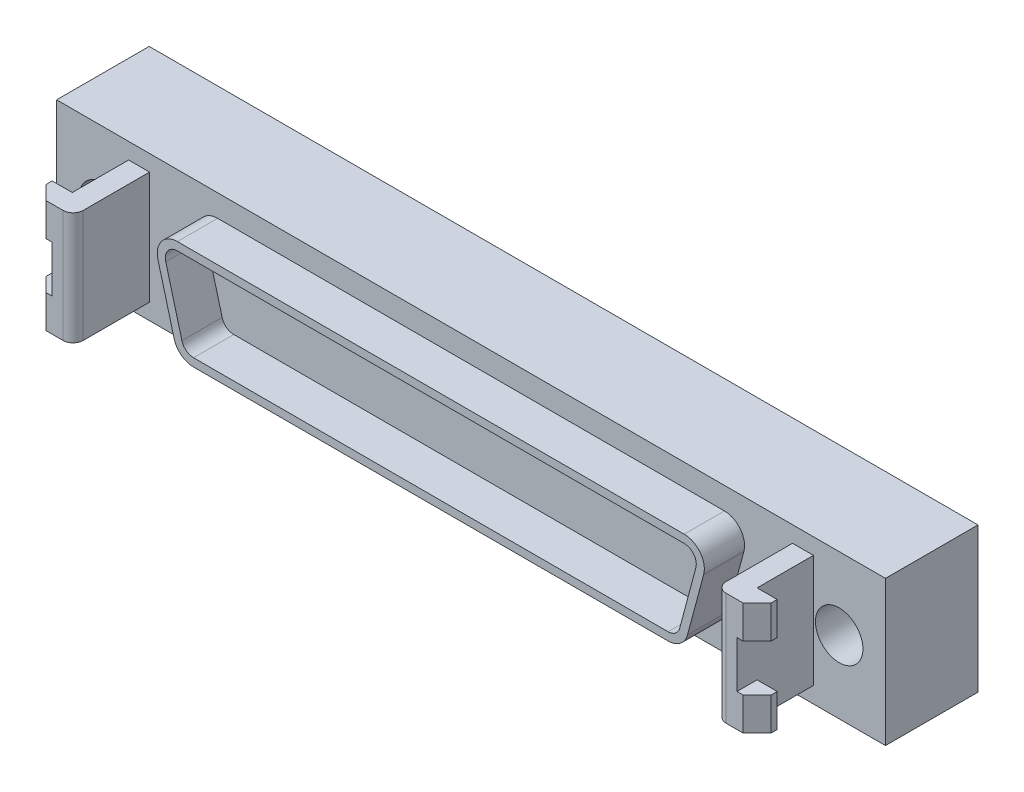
SolidWorks part; units mm, degrees
ref_plane "Front Plane" through (0, 0, 0) normal (0, 0, 1) x (1, 0, 0)
ref_plane "Top Plane" through (0, 0, 0) normal (0, 1, 0) x (1, 0, 0)
ref_plane "Right Plane" through (0, 0, 0) normal (1, 0, 0) x (0, 0, -1)
sketch "Base Outline" plane through (0, 0, 0) normal (0, 0, 1) x (1, 0, 0)
  line L0 (26.162, 0) -> (-26.162, 0) construction
  line L2 (-26.162, 4.572) -> (26.162, 4.572)
  line L3 (-26.162, 4.572) -> (-26.162, -4.572)
  line L4 (-26.162, -4.572) -> (26.162, -4.572)
  line L5 (26.162, 4.572) -> (26.162, -4.572)
  circle A0 centre (-23.241, 0) radius 1.4986
  circle A1 centre (23.241, 0) radius 1.4986
  point P5 (0, 0)
  point P6 (-26.162, 4.572)
  point P8 (26.162, -4.572)
  point P11 (-23.241, 0)
  point P12 (23.241, 0)
  dimension "D6" = 2.9972
  dimension "D7" = 2.9972
  dimension "D1" = 52.324
  dimension "D2" = 4.572
  dimension "D3" = 4.572
  dimension "D4" = 2.921
  dimension "D5" = 2.921
extrude "Connector Base" add sketch "Base Outline" along normal blind 5.842
sketch "Connector Outline" plane through (0, 0, 5.842) normal (0, 0, 1) x (1, 0, 0)
  line L0 (-15.9979, 3.175) -> (15.9979, 3.175)
  line L1 (-17.653, 3.175) -> (-17.653, -2.8641) construction
  line L2 (17.653, 3.175) -> (17.653, -2.8641) construction
  line L3 (-17.2246, 1.5763) -> (-16.2037, -2.2337)
  line L4 (17.2246, 1.5763) -> (16.2037, -2.2337)
  line L5 (14.977, -3.175) -> (-14.977, -3.175)
  arc A0 (-17.2246, 1.5763) -> (-15.9979, 3.175) centre (-15.9979, 1.905) cw
  arc A1 (-14.977, -3.175) -> (-16.2037, -2.2337) centre (-14.977, -1.905) cw
  arc A2 (16.2037, -2.2337) -> (14.977, -3.175) centre (14.977, -1.905) cw
  arc A3 (17.2246, 1.5763) -> (15.9979, 3.175) centre (15.9979, 1.905) ccw
  point P2 (0, 0)
  point P3 (0, 3.175)
  dimension "D6" = 1.27
  dimension "D7" = 1.27
  dimension "D1" = 3.175
  dimension "D2" = 35.306
  dimension "D3" = 3.175
  dimension "D4" = 15
  dimension "D5" = 15
extrude "Connector" add sketch "Connector Outline" along normal blind 2.54 thin
sketch "Clip Outline" plane through (0, 0, 0) normal (0, 1, 0) x (1, 0, 0)
  line L0 (-21.6154, -5.842) -> (-20.2946, -5.842)
  line L1 (26.162, -5.842) -> (-26.162, -5.842) construction
  line L2 (-20.2946, -5.842) -> (-20.2946, -10.033)
  line L3 (-20.9296, -10.668) -> (-22.0069, -10.668)
  line L4 (-22.8854, -9.7895) -> (-22.8854, -9.398)
  line L5 (-22.8854, -9.398) -> (-21.6154, -9.398)
  line L6 (-21.6154, -9.398) -> (-21.6154, -5.842)
  line L7 (-22.0069, -10.668) -> (-22.8854, -9.7895)
  arc A0 (-20.9296, -10.668) -> (-20.2946, -10.033) centre (-20.9296, -10.033) ccw
  point P6 (-21.6154, -5.842)
  point P10 (-22.8854, -9.7895)
  point P11 (-22.0069, -10.668)
  dimension "D5" = 0.635
  dimension "D1" = 1.27
  dimension "D2" = 1.27
  dimension "D3" = 1.3208
  dimension "D4" = 0.127
extrude "Clip" add sketch "Clip Outline" along normal mid plane 7.112
sketch "Cut Outline" plane through (0, 0, 9.398) normal (0, 0, -1) x (-1, 0, 0)
  line L0 (21.6154, 3.556) -> (21.6154, -3.556) construction
  line L1 (21.6154, -1.4732) -> (22.8854, -1.4732)
  line L2 (21.6154, -1.4732) -> (21.6154, 1.4732)
  line L3 (21.6154, 1.4732) -> (22.8854, 1.4732)
  line L4 (22.8854, -1.4732) -> (22.8854, 1.4732)
  line L5 (22.8854, 3.556) -> (22.8854, -3.556) construction
extrude "Clip Cut" cut sketch "Cut Outline" against normal up to next
mirror "Clip Mirror" about plane through (0, 0, 0) normal (1, 0, 0) of "Clip", "Clip Cut"
